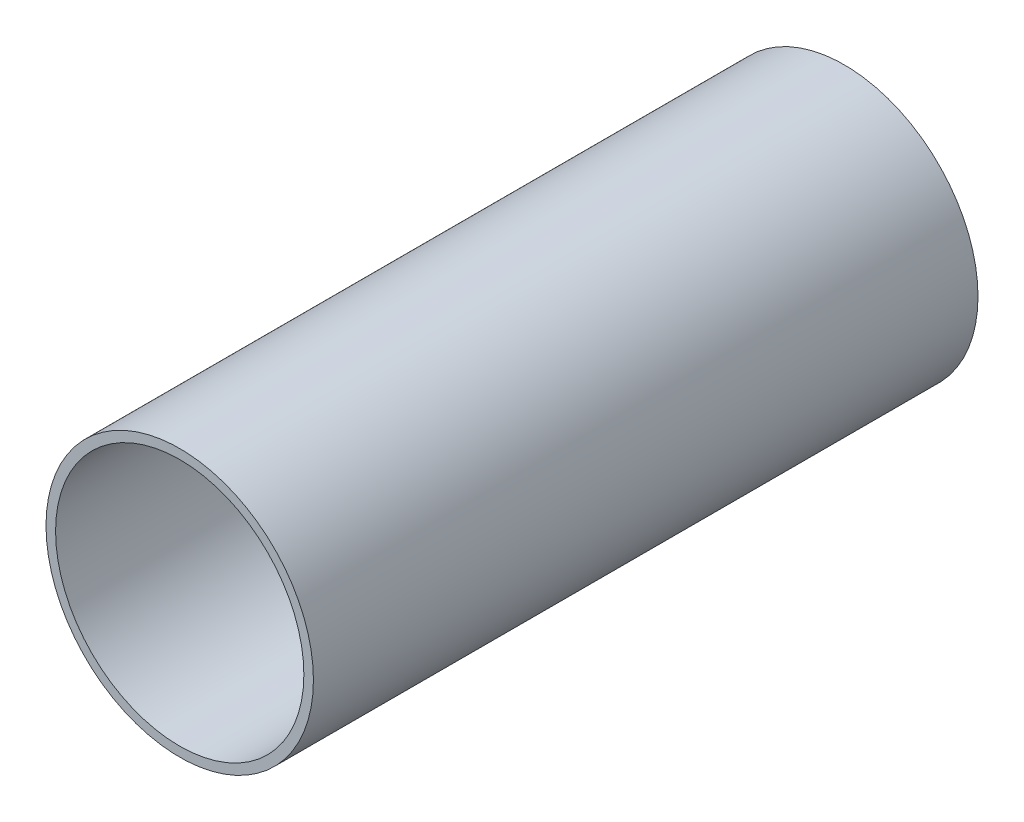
SolidWorks part; units mm, degrees
ref_plane "Plan de face" through (0, 0, 0) normal (0, 0, 1) x (1, 0, 0)
ref_plane "Plan de dessus" through (0, 0, 0) normal (0, 1, 0) x (1, 0, 0)
ref_plane "Plan de droite" through (0, 0, 0) normal (1, 0, 0) x (0, 0, -1)
sketch "Esquisse1" plane through (0, 0, 0) normal (0, 0, 1) x (1, 0, 0)
  circle A0 centre (0, 0) radius 50.3
  circle A1 centre (0, 0) radius 46.7
  dimension "D1" = 3.6
  dimension "D2" = 100.6
extrude "Extrusion1" add sketch "Esquisse1" along normal blind 250
